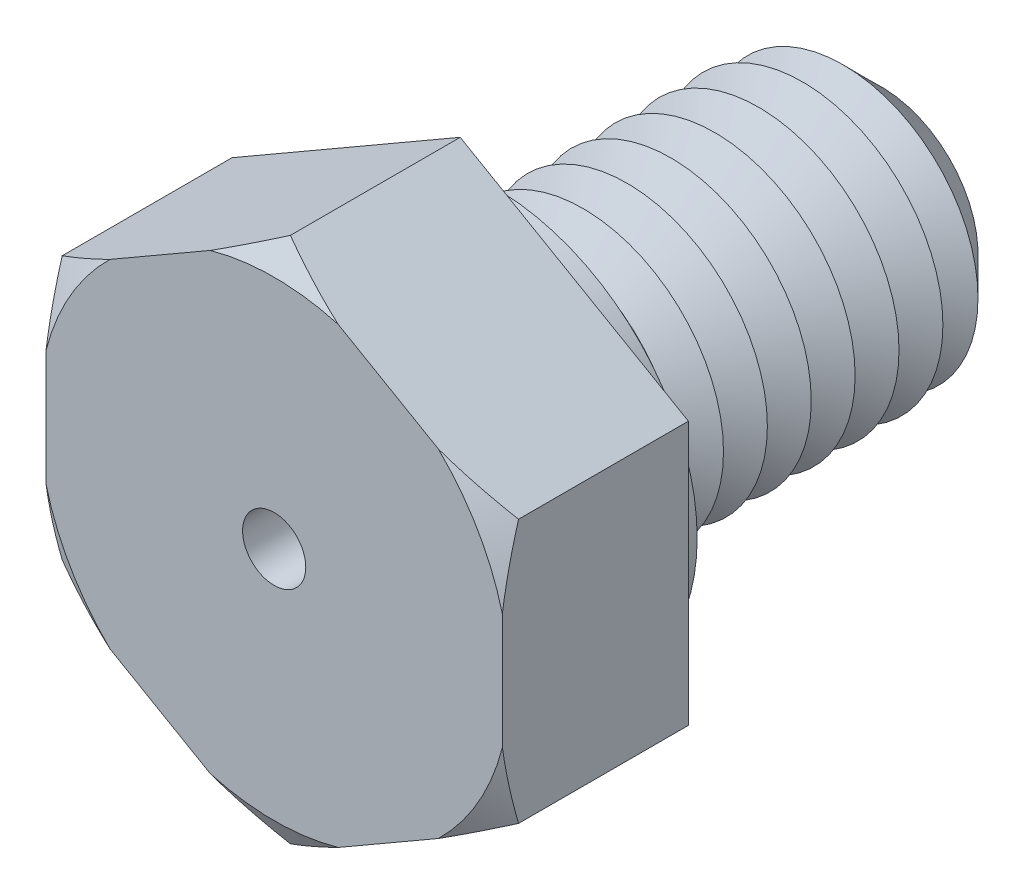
SolidWorks part; units mm, degrees
ref_plane "Front Plane" through (0, 0, 0) normal (0, 0, 1) x (1, 0, 0)
ref_plane "Top Plane" through (0, 0, 0) normal (0, 1, 0) x (1, 0, 0)
ref_plane "Right Plane" through (0, 0, 0) normal (1, 0, 0) x (0, 0, -1)
sketch "Sketch2" plane through (0, 0, 0) normal (0, 0, 1) x (1, 0, 0)
  line L1 (0, 7.5056) -> (-6.5, 3.7528)
  line L2 (-6.5, 3.7528) -> (-6.5, -3.7528)
  line L3 (-6.5, -3.7528) -> (0, -7.5056)
  line L4 (0, -7.5056) -> (6.5, -3.7528)
  line L5 (6.5, -3.7528) -> (6.5, 3.7528)
  line L6 (6.5, 3.7528) -> (0, 7.5056)
  circle A0 centre (0, 0) radius 6.5 construction
  dimension "D1" = 13
extrude "Boss-Extrude1" add sketch "Sketch2" along normal blind 5.3
sketch "Sketch3" plane through (0, 0, 0) normal (0, 0, -1) x (-1, 0, 0)
  circle A0 centre (0, 0) radius 4
  dimension "D1" = 8
extrude "Boss-Extrude2" add sketch "Sketch3" along normal blind 12
sketch "Sketch4" plane through (0, 0, 0) normal (0, 0, -1) x (-1, 0, 0)
  circle A0 centre (0, 0) radius 5.75
  dimension "D1" = 11.5
extrude "Boss-Extrude3" add sketch "Sketch4" along normal blind 1
sketch "Sketch5" plane through (0, 0, 0) normal (1, 0, 0) x (0, 0, -1)
  line L0 (-3.2117, 0) -> (6.3192, 0) construction
chamfer "Chamfer1" distance 1.25 angle 45 1 edges at (-4, 0, -12)
sketch "Sketch6" plane through (0, 0, 0) normal (1, 0, 0) x (0, 0, -1)
  line L0 (1, 4) -> (1.625, 2.9175)
  line L1 (1.625, 2.9175) -> (2.25, 4)
  line L2 (10.75, 4) -> (1, 4) construction
  line L3 (2.25, 4) -> (1, 4)
  dimension "D1" = 1.25
revolve "Cut-Revolve1" cut sketch "Sketch6" angle 360 about L0
pattern_linear "LPattern1" count 8 spacing 1.25 along (0, 0, -1) of "Cut-Revolve1"
sketch "Sketch7" plane through (0, 0, 0) normal (1, 0, 0) x (0, 0, -1)
  line L0 (-5.3, 7.5056) -> (-5.3, 6.7056)
  line L1 (-5.3, 3.7528) -> (-5.3, 7.5056) construction
  line L2 (-5.3, 6.7056) -> (-4.8381, 7.5056)
  line L3 (-5.3, 7.5056) -> (0, 7.5056) construction
  line L4 (-4.8381, 7.5056) -> (-5.3, 7.5056)
  dimension "D1" = 0.8
  dimension "D2" = 30
revolve "Cut-Revolve2" cut sketch "Sketch7" angle 360 about L0
sketch "Sketch8" plane through (0, 0, 5.3) normal (0, 0, 1) x (1, 0, 0)
  circle A0 centre (0, 0) radius 0.9
  dimension "D1" = 1.8
extrude "Cut-Extrude1" cut sketch "Sketch8" against normal up to surface (17.3 mm away)
